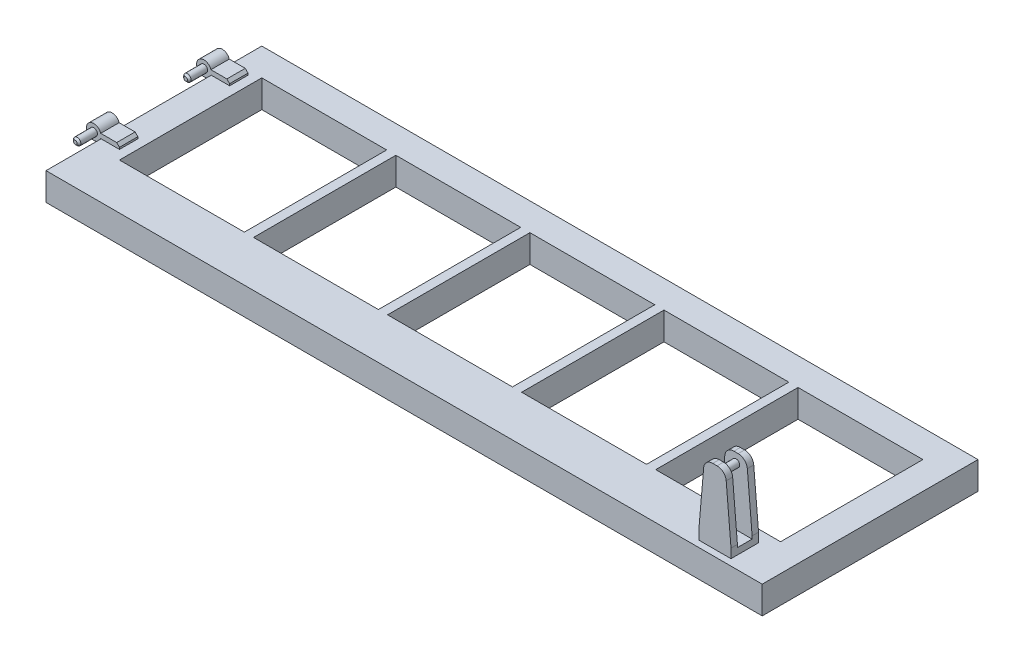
SolidWorks part; units mm, degrees
ref_plane "Plan1" through (0, 0, 0) normal (0, 0, 1) x (1, 0, 0)
ref_plane "Plan2" through (0, 0, 0) normal (0, 1, 0) x (1, 0, 0)
ref_plane "Plan3" through (0, 0, 0) normal (1, 0, 0) x (0, 0, -1)
sketch "Esquisse1" plane through (0, 0, 0) normal (0, 0, 1) x (1, 0, 0)
  line L1 (0, 0) -> (30, 0)
  line L2 (0, 0) -> (0, 30)
  line L3 (0, 30) -> (30, 30)
  line L4 (30, 0) -> (30, 30)
  dimension "D1" = 30
  dimension "D2" = 30
extrude "Base-Extrusion" add sketch "Esquisse1" along normal blind 235
sketch "Esquisse2" plane through (30, 0, 0) normal (1, 0, 0) x (0, 0, -1)
  line L0 (-235, 0) -> (0, 0) construction
  line L1 (-235, 30) -> (-185, 30)
  line L2 (-235, 30) -> (-235, 0)
  line L3 (-235, 0) -> (-185, 0)
  line L4 (-185, 30) -> (-185, 0)
  line L7 (-30, 30) -> (-30, 0)
  line L8 (0, 0) -> (-30, 0)
  line L9 (0, 30) -> (0, 0)
  line L10 (0, 30) -> (-30, 30)
  line L12 (0, 0) -> (0, 30) construction
  line L13 (-235, 30) -> (0, 30) construction
  dimension "D1" = 30
  dimension "D2" = 50
extrude "Boss.-Extru.1" add sketch "Esquisse2" along normal blind 720
sketch "Esquisse3" plane through (750, 0, 0) normal (1, 0, 0) x (0, 0, -1)
  line L1 (0, 30) -> (-235, 30)
  line L2 (0, 30) -> (0, 0)
  line L3 (0, 0) -> (-235, 0)
  line L4 (-235, 30) -> (-235, 0)
extrude "Boss.-Extru.2" add sketch "Esquisse3" along normal blind 30
sketch "Esquisse4" plane through (0, 0, 235) normal (0, 0, 1) x (1, 0, 0)
  line L0 (390, 30) -> (390, -150) construction
  line L1 (780, 30) -> (0, 30) construction
  line L2 (166, 30) -> (176, 30)
  line L3 (312, 30) -> (322, 30)
  line L4 (312, 30) -> (312, 0)
  line L5 (312, 0) -> (322, 0)
  line L6 (322, 30) -> (322, 0)
  line L7 (166, 30) -> (166, 0)
  line L8 (166, 0) -> (176, 0)
  line L9 (176, 30) -> (176, 0)
  line L10 (0, 0) -> (780, 0) construction
  line L11 (604, 30) -> (604, 0)
  line L12 (614, 0) -> (604, 0)
  line L13 (614, 30) -> (614, 0)
  line L14 (458, 30) -> (458, 0)
  line L15 (468, 0) -> (458, 0)
  line L16 (468, 30) -> (468, 0)
  line L17 (468, 30) -> (458, 30)
  line L18 (614, 30) -> (604, 30)
  line L19 (30, 30) -> (166, 30) construction
  line L20 (176, 30) -> (312, 30) construction
  line L21 (322, 30) -> (458, 30) construction
  line L22 (468, 30) -> (604, 30) construction
  line L23 (614, 30) -> (750, 30) construction
  dimension "D1" = 10
extrude "Boss.-Extru.3" add sketch "Esquisse4" along normal up to surface (205 mm away)
sketch "Esquisse5" plane through (0, 30, 0) normal (0, 1, 0) x (-1, 0, 0)
  line L0 (-780, 235) -> (0, 235) construction
  line L1 (-20, 175) -> (8, 175)
  line L2 (-20, 175) -> (-20, 155)
  line L3 (-20, 155) -> (8, 155)
  line L4 (8, 175) -> (8, 155)
  line L5 (0, 235) -> (0, 0) construction
  dimension "D1" = 60
  dimension "D2" = 20
  dimension "D3" = 20
  dimension "D4" = 8
extrude "Boss.-Extru.4" add sketch "Esquisse5" along normal blind 5
sketch "Esquisse6" plane through (0, 0, 175) normal (0, 0, 1) x (1, 0, 0)
  line L0 (-8, 35) -> (-8, 30) construction
  circle A0 centre (-8, 32.5) radius 8
  dimension "D1" = 16
extrude "Boss.-Extru.5" add sketch "Esquisse6" against normal up to surface (20 mm away)
sketch "Esquisse7" plane through (0, 0, 175) normal (0, 0, 1) x (1, 0, 0)
  circle A0 centre (-8, 32.5) radius 4
  arc A1 (-0.4007, 35) -> (-0.4007, 30) centre (-8, 32.5) ccw construction
  dimension "D1" = 8
extrude "Boss.-Extru.6" add sketch "Esquisse7" along normal blind 20
chamfer "Chanfrein1" distance 2 angle 45 1 edges at (-4, 32.5, 195)
sketch "Esquisse8" plane through (5.8973, 30, -103.7542) normal (0, 1, 0) x (-1, 0, 0)
  line L1 (-14.1027, 158.7542) -> (13.8973, 158.7542)
  line L2 (-14.1027, 158.7542) -> (-14.1027, 138.7542)
  line L3 (-14.1027, 138.7542) -> (13.8973, 138.7542)
  line L4 (13.8973, 158.7542) -> (13.8973, 138.7542)
  line L5 (5.8973, 258.7542) -> (5.8973, 103.7542) construction
  line L6 (-14.1027, 278.7542) -> (-14.1027, 258.7542) construction
  line L7 (5.8973, 278.7542) -> (-14.1027, 278.7542) construction
  dimension "D1" = 8
  dimension "D2" = 20
  dimension "D3" = 120
extrude "Boss.-Extru.7" add sketch "Esquisse8" along normal blind 5
sketch "Esquisse9" plane through (5.8973, 0, 55) normal (0, 0, 1) x (1, 0, 0)
  line L0 (-13.8973, 35) -> (-13.8973, 30) construction
  circle A0 centre (-13.8973, 32.5) radius 8
  dimension "D1" = 16
extrude "Boss.-Extru.8" add sketch "Esquisse9" against normal up to surface (20 mm away)
sketch "Esquisse10" plane through (5.8973, 0, 55) normal (0, 0, 1) x (1, 0, 0)
  circle A0 centre (-13.8973, 32.5) radius 4
  arc A1 (-6.2979, 35) -> (-6.2979, 30) centre (-13.8973, 32.5) ccw construction
  dimension "D1" = 8
extrude "Boss.-Extru.9" add sketch "Esquisse10" along normal blind 20
chamfer "Chanfrein2" distance 2 angle 45 1 edges at (-4, 32.5, 75)
chamfer "Chanfrein3" distance 3 angle 45 2 edges at (20, 35, 165) (20, 35, 45)
sketch "Esquisse11" plane through (0, 30, 0) normal (0, 1, 0) x (-1, 0, 0)
  line L0 (-780, 0) -> (-780, 235) construction
  line L1 (-704, 198) -> (-739, 198)
  line L2 (-704, 198) -> (-704, 205)
  line L3 (-704, 205) -> (-739, 205)
  line L4 (-739, 198) -> (-739, 205)
  line L5 (-704, 221) -> (-739, 221)
  line L6 (-704, 221) -> (-704, 228)
  line L7 (-704, 228) -> (-739, 228)
  line L8 (-739, 221) -> (-739, 228)
  line L9 (-780, 235) -> (0, 235) construction
  dimension "D1" = 41
  dimension "D2" = 35
  dimension "D3" = 16
  dimension "D4" = 7
  dimension "D5" = 7
  dimension "D6" = 7
extrude "Boss.-Extru.10" add sketch "Esquisse11" along normal blind 80
chamfer "Chanfrein4" distance 70 distance2 6 4 edges at (704, 110, 201.5) (739, 110, 201.5) (704, 110, 224.5) (739, 110, 224.5)
fillet "Congé1" radius 10 4 edges at (710, 110, 201.5) (733, 110, 201.5) (710, 110, 224.5) (733, 110, 224.5)
sketch "Esquisse12" plane through (0, 0, 198) normal (0, 0, -1) x (-1, 0, 0)
  line L0 (-721.5, 110) -> (-721.5, 62.7807) construction
  line L1 (-723.8205, 110) -> (-719.1795, 110) construction
  line L2 (-780, 30) -> (0, 30) construction
  circle A0 centre (-721.5, 100) radius 4
  dimension "D1" = 8
  dimension "D2" = 70
extrude "Boss.-Extru.11" add sketch "Esquisse12" along normal up to surface (30 mm away)
sketch "Esquisse13" plane through (0, 30, 0) normal (0, 1, 0) x (-1, 0, 0)
  line L0 (-739, 205) -> (-733.7839, 205) construction
  line L1 (-704, 221) -> (-739, 221)
  line L2 (-704, 221) -> (-704, 205)
  line L3 (-704, 205) -> (-739, 205)
  line L4 (-739, 221) -> (-739, 205)
extrude "Boss.-Extru.12" add sketch "Esquisse13" along normal blind 7
sketch "Esq_WRNL_Compact001" plane through (0, 0, 0) normal (0, 0, 1) x (1, 0, 0)
  line L0 (-17, -1) -> (-17, 111)
  line L1 (781, -1) -> (781, 111)
  line L2 (-17, -1) -> (781, -1)
  line L3 (-17, 111) -> (781, 111)
ref_plane "Plan5" through (0, 0, 213) normal (0, 0, -1) x (-1, 0, 0)
sketch "POINT ENCRAGE PORTAIL" plane through (0, 0, 213) normal (0, 0, -1) x (-1, 0, 0)
  point P0 (-721.5, 100)
